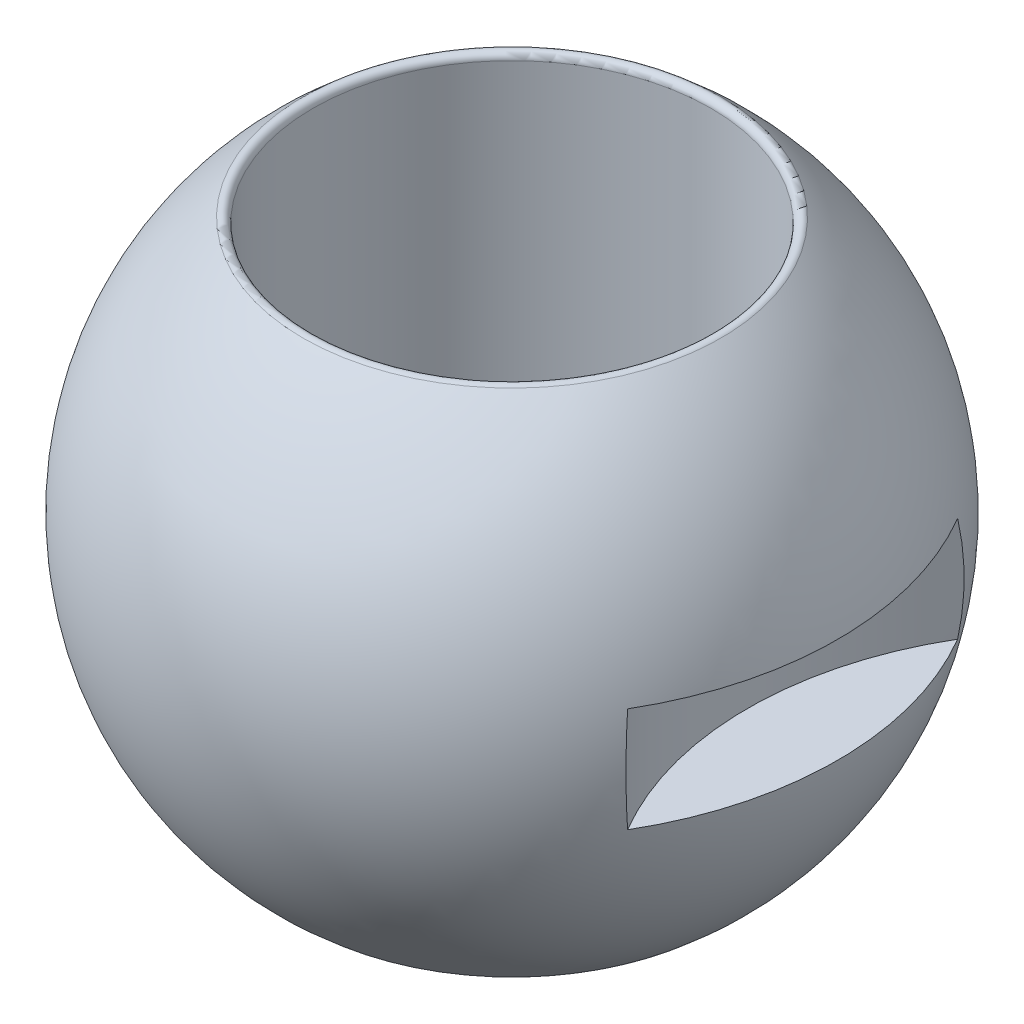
SolidWorks part; units mm, degrees
ref_plane "前基準面" through (0, 0, 0) normal (0, 0, 1) x (1, 0, 0)
ref_plane "上基準面" through (0, 0, 0) normal (0, 1, 0) x (1, 0, 0)
ref_plane "右基準面" through (0, 0, 0) normal (1, 0, 0) x (0, 0, -1)
sketch "草圖1" plane through (0, 0, 0) normal (0, 0, 1) x (1, 0, 0)
  line L0 (0, 12.9867) -> (0, -12.9867) construction
  line L1 (19, 23.9105) -> (19, -23.9105)
  line L2 (16.7744, -24.5) -> (21.6508, -24.5) construction
  line L3 (17.7096, 24.5) -> (22.4524, 24.5) construction
  arc A0 (19.963, -24.3665) -> (19.963, 24.3665) centre (0, 0) ccw
  arc A1 (19.963, 24.3665) -> (19, 23.9105) centre (19.5895, 23.9105) ccw
  arc A2 (19, -23.9105) -> (19.963, -24.3665) centre (19.5895, -23.9105) ccw
  dimension "D1" = 38
  dimension "D3" = 49
  dimension "D2" = 63
revolve "旋轉1" add sketch "草圖1" angle 360 about L0
sketch "草圖5" plane through (0, 0, 0) normal (0, 0, 1) x (1, 0, 0)
  line L0 (0, 35.0339) -> (0, -34.6391) construction
  line L1 (0, 0) -> (49.4223, 0) construction
  line L2 (-38.7119, 38.7119) -> (38.7119, -38.7119) construction
  line L3 (-29, 29) -> (-20, 29)
  line L4 (-29, 29) -> (-29, 22)
  line L5 (-29, 22) -> (-22.5444, 22)
  line L6 (-20, 29) -> (-20, 24.3362)
  line L7 (24.3362, -20) -> (29, -20)
  line L8 (22, -22.5444) -> (22, -29)
  line L9 (22, -29) -> (29, -29)
  line L10 (29, -20) -> (29, -29)
  arc A0 (-20, 24.3362) -> (-22.5444, 22) centre (0, 0) ccw
  arc A1 (22, -22.5444) -> (24.3362, -20) centre (0, 0) ccw
  arc A2 (-19.963, 24.3665) -> (-19.963, -24.3665) centre (0, 0) ccw construction
  dimension "D1" = 58
  dimension "D2" = 40
  dimension "D3" = 58
  dimension "D4" = 7
  dimension "D5" = 29
  dimension "D6" = 29
  dimension "D7" = 45
sketch "草圖2" plane through (0, 0, 0) normal (0, 1, 0) x (1, 0, 0)
  line L0 (-2.7851, 0) -> (27.8268, 0) construction
  arc A0 (27.0421, 16.1548) -> (27.0421, -16.1548) centre (53.5, 0) ccw
  arc A1 (27.0421, 16.1548) -> (27.0421, -16.1548) centre (0, 0) cw
  circle A2 centre (0, 0) radius 31.5 construction
  dimension "D2" = 31
  dimension "D1" = 53.5
extrude "除料-伸長1" cut sketch "草圖2" against normal mid plane 10
sketch "草圖3" plane through (0, 0, 0) normal (1, 0, 0) x (0, 0, -1)
  line L0 (-15.7658, 5) -> (15.7658, 5) construction
  line L1 (0, 3.3429) -> (0, -1.854) construction
  circle A0 centre (0, 3.5) radius 1.5
  dimension "D1" = 3
extrude "除料-伸長2" cut sketch "草圖3" along normal through all
